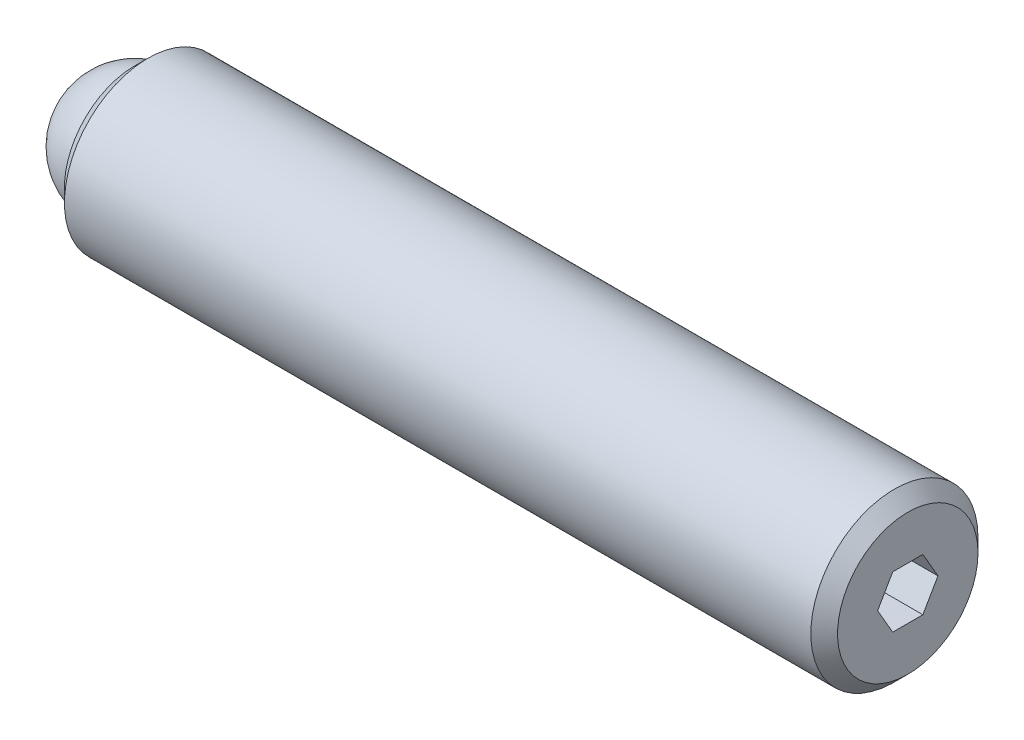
SolidWorks part; units mm, degrees
ref_plane "Front Plane" through (0, 0, 0) normal (0, 0, 1) x (1, 0, 0)
ref_plane "Top Plane" through (0, 0, 0) normal (0, 1, 0) x (1, 0, 0)
ref_plane "Right Plane" through (0, 0, 0) normal (1, 0, 0) x (0, 0, -1)
sketch "Sketch2" plane through (0, 0, 0) normal (1, 0, 0) x (0, 0, -1)
  circle A0 centre (0, 0) radius 3.175
  dimension "D1" = 6.35
extrude "Boss-Extrude1" add sketch "Sketch2" along normal blind 29.3687
sketch "Sketch3" plane through (0, 0, 0) normal (-1, 0, 0) x (0, 0, 1)
  circle A0 centre (0, 0) radius 2.3813
  dimension "D1" = 4.7625
chamfer "Chamfer1" distance 0.508 angle 45 1 edges at (0, 0, -3.175)
chamfer "Chamfer2" distance 0.508 angle 45 1 edges at (29.3687, 0, -3.175)
sketch "Sketch4" plane through (29.3687, 0, 0) normal (1, 0, 0) x (0, 0, -1)
  line L1 (1.1457, 0) -> (0.5728, 0.9922)
  line L2 (0.5728, 0.9922) -> (-0.5728, 0.9922)
  line L3 (-0.5728, 0.9922) -> (-1.1457, 0)
  line L4 (-1.1457, 0) -> (-0.5728, -0.9922)
  line L5 (-0.5728, -0.9922) -> (0.5728, -0.9922)
  line L6 (0.5728, -0.9922) -> (1.1457, 0)
  circle A0 centre (0, 0) radius 0.9922 construction
  dimension "D1" = 1.9844
extrude "Cut-Extrude2" cut sketch "Sketch4" against normal blind 2.286
extrude "Cut-Extrude3" cut sketch "Sketch3" against normal blind 1.9844
sketch "Sketch5" plane through (0, 0, 0) normal (-1, 0, 0) x (0, 0, 1)
  line L0 (0, 0) -> (0, -2.3813)
  line L1 (0, 0) -> (0, 2.3813)
  arc A0 (0, 2.3813) -> (0, -2.3813) centre (0, 0) ccw
  dimension "D1" = 2.3813
revolve "Revolve1" add sketch "Sketch5" angle 360 about L1
